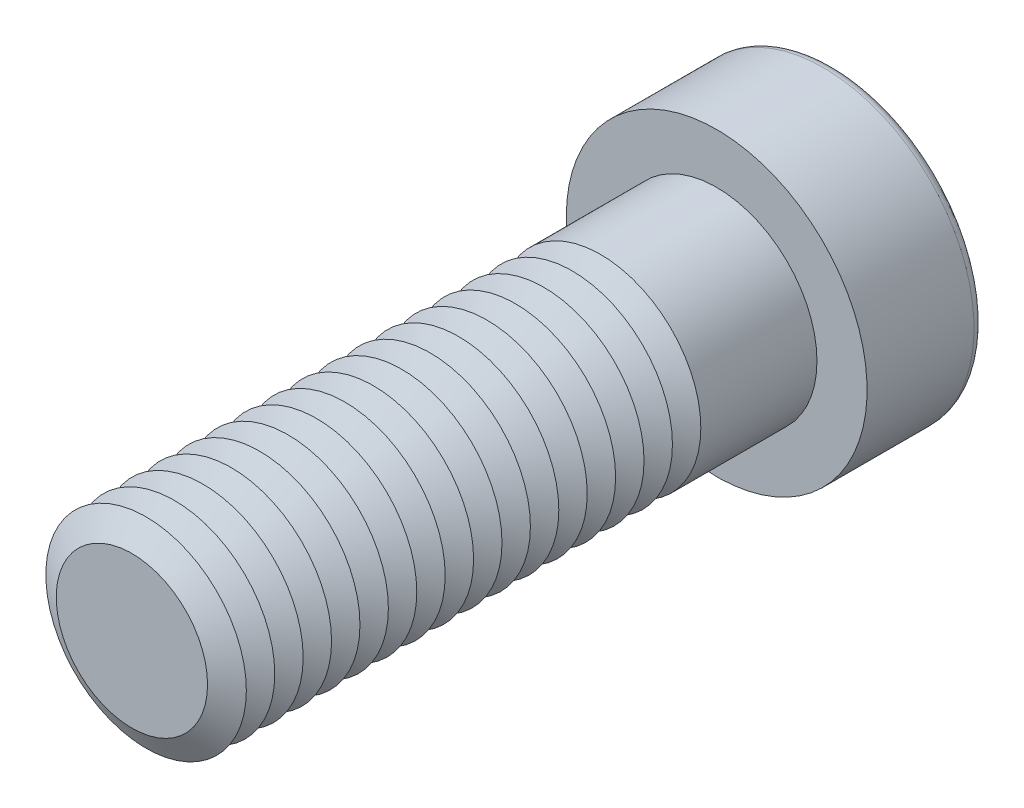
SolidWorks part; units mm, degrees
ref_plane "Front Plane" through (0, 0, 0) normal (0, 0, 1) x (1, 0, 0)
ref_plane "Top Plane" through (0, 0, 0) normal (0, 1, 0) x (1, 0, 0)
ref_plane "Right Plane" through (0, 0, 0) normal (1, 0, 0) x (0, 0, -1)
sketch "Sketch1" plane through (0, 0, 0) normal (0, 0, 1) x (1, 0, 0)
  circle A0 centre (0, 0) radius 6
  dimension "D1" = 12
extrude "Boss-Extrude1" add sketch "Sketch1" along normal blind 35
sketch "Sketch2" plane through (0, 0, 0) normal (0, 0, -1) x (-1, 0, 0)
  circle A0 centre (0, 0) radius 9
  dimension "D1" = 18
extrude "Boss-Extrude2" add sketch "Sketch2" along normal blind 7
sketch "Sketch3" plane through (0, 0, -7) normal (0, 0, -1) x (-1, 0, 0)
  line L1 (-2.3094, 4) -> (-4.6188, 0)
  line L2 (-4.6188, 0) -> (-2.3094, -4)
  line L3 (-2.3094, -4) -> (2.3094, -4)
  line L4 (2.3094, -4) -> (4.6188, 0)
  line L5 (4.6188, 0) -> (2.3094, 4)
  line L6 (2.3094, 4) -> (-2.3094, 4)
  circle A0 centre (0, 0) radius 4 construction
  dimension "D1" = 8
extrude "Cut-Extrude1" cut sketch "Sketch3" against normal blind 6
fillet "Fillet1" radius 0.6 1 edges at (-9, 0, -7)
sketch "Sketch4" plane through (0, 0, -1) normal (0, 0, -1) x (-1, 0, 0)
  line L0 (2.3094, -4) -> (4.6188, 0) construction
  circle A0 centre (0, 0) radius 4
extrude "Cut-Extrude2" cut sketch "Sketch4" against normal through all draft 60
sketch "Sketch5" plane through (0, 0, -7) normal (0, 0, -1) x (-1, 0, 0)
  circle A0 centre (0, 0) radius 4.6188
extrude "Cut-Extrude3" cut sketch "Sketch5" against normal through all draft 75
sketch "Sketch7" plane through (0, 0, 0) normal (1, 0, 0) x (0, 0, -1)
  line L25 (-35, 4.5278) -> (-34.15, 6)
  line L26 (-35, 6) -> (-35, -6) construction
  line L27 (-34.15, 6) -> (-35.85, 6)
  line L28 (-35.85, 6) -> (-35, 4.5278)
  line L29 (0, 6) -> (-35, 6) construction
  dimension "D1" = 1.7
revolve "Cut-Revolve1" cut sketch "Sketch7" angle 360 about axis through (0, 0, 35) along (0, 0, -1)
pattern_linear "LPattern1" count 17 spacing 1.7 along (0, 0, -1) of "Cut-Revolve1"
